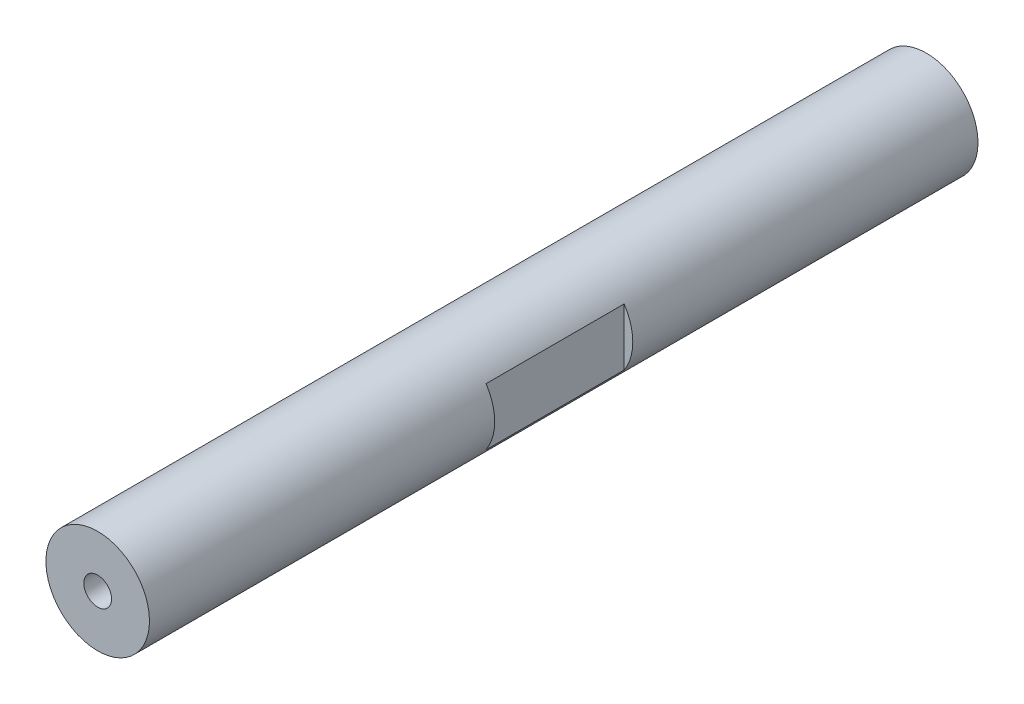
SolidWorks part; units mm, degrees
ref_plane "Front Plane" through (0, 0, 0) normal (0, 0, 1) x (1, 0, 0)
ref_plane "Top Plane" through (0, 0, 0) normal (0, 1, 0) x (1, 0, 0)
ref_plane "Right Plane" through (0, 0, 0) normal (1, 0, 0) x (0, 0, -1)
sketch "Sketch1" plane through (0, 0, 0) normal (0, 0, 1) x (1, 0, 0)
  circle A0 centre (0, 0) radius 9.525
  dimension "D1" = 19.05
extrude "Boss-Extrude1" add sketch "Sketch1" along normal mid plane 152.4
hole_wizard "1/4-20 Tapped Hole1" positions "Sketch2" profile "Sketch4" tap size "1/4-20" standard "ANSI Inch"
sketch "Sketch2" plane through (0, 0, 76.2) normal (0, 0, 1) x (1, 0, 0)
  point P0 (0, 0)
sketch "Sketch4" plane through (0, 0, 76.2) normal (1, 0, 0) x (0, -1, 0)
  line L0 (0, 0) -> (0, 33.2838)
  line L1 (0, 33.2838) -> (2.5527, 31.75)
  line L2 (2.5527, 31.75) -> (2.5527, 0)
  line L5 (2.5527, 0) -> (0, 0)
  line L10 (0, 33.2838) -> (-2.5527, 31.75) construction
  line L11 (0, -6.35) -> (0, 107.95) construction
  dimension "Tap Drill Dia." = 5.1054
  dimension "Tap Drill Depth" = 31.75
  dimension "Drill Angle" = 118
mirror "Mirror1" about plane through (0, 0, 0) normal (0, 0, 1) of "1/4-20 Tapped Hole1"
sketch "Sketch5" plane through (0, 0, 0) normal (0, 1, 0) x (1, 0, 0)
  line L0 (-9.525, -76.2) -> (9.525, -76.2) construction
  line L1 (9.525, 76.2) -> (-9.525, 76.2) construction
  line L2 (-9.525, -76.2) -> (9.525, -76.2) construction
  line L3 (9.525, 76.2) -> (-9.525, 76.2) construction
  line L4 (-9.525, -76.2) -> (-9.525, 76.2) construction
  line L5 (9.525, 76.2) -> (9.525, -76.2) construction
  line L11 (7.9375, -12.7) -> (-7.9375, -12.7) construction
  line L12 (7.9375, -12.7) -> (7.9375, 12.7) construction
  line L13 (7.9375, 12.7) -> (-7.9375, 12.7) construction
  line L14 (-7.9375, -12.7) -> (-7.9375, 12.7) construction
  line L15 (7.9375, -12.7) -> (-7.9375, 12.7) construction
  line L16 (7.9375, 12.7) -> (-7.9375, -12.7) construction
  line L17 (-7.9375, -12.7) -> (-9.525, -12.7)
  line L18 (-7.9375, -12.7) -> (-7.9375, 12.7)
  line L19 (-7.9375, 12.7) -> (-9.525, 12.7)
  line L20 (-9.525, -12.7) -> (-9.525, 12.7)
  line L21 (7.9375, -12.7) -> (9.525, -12.7)
  line L22 (7.9375, -12.7) -> (7.9375, 12.7)
  line L23 (7.9375, 12.7) -> (9.525, 12.7)
  line L24 (9.525, -12.7) -> (9.525, 12.7)
  point P4 (0, 0)
  dimension "D1" = 15.875
  dimension "D2" = 25.4
extrude "Cut-Extrude1" cut sketch "Sketch5" against normal through all both and the other way through all
